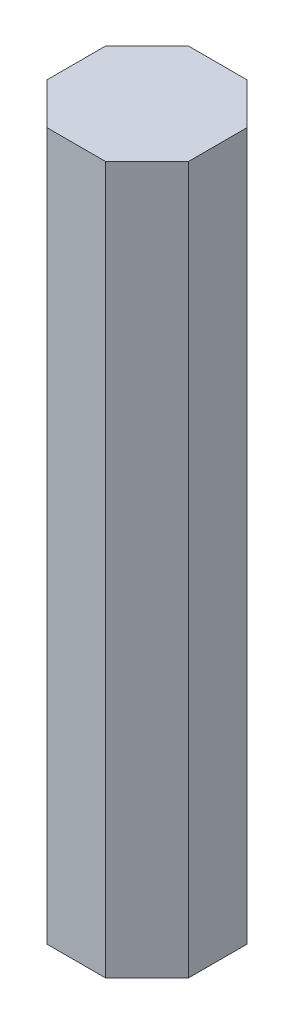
SolidWorks part; units mm, degrees
ref_plane "Plan de face" through (0, 0, 0) normal (0, 0, 1) x (1, 0, 0)
ref_plane "Plan de dessus" through (0, 0, 0) normal (0, 1, 0) x (1, 0, 0)
ref_plane "Plan de droite" through (0, 0, 0) normal (1, 0, 0) x (0, 0, -1)
sketch "Esquisse1" plane through (0, 0, 0) normal (0, 1, 0) x (1, 0, 0)
  line L1 (41.4214, -100) -> (100, -41.4214)
  line L2 (100, -41.4214) -> (100, 41.4214)
  line L3 (100, 41.4214) -> (41.4214, 100)
  line L4 (41.4214, 100) -> (-41.4214, 100)
  line L5 (-41.4214, 100) -> (-100, 41.4214)
  line L6 (-100, 41.4214) -> (-100, -41.4214)
  line L7 (-100, -41.4214) -> (-41.4214, -100)
  line L8 (-41.4214, -100) -> (41.4214, -100)
  circle A0 centre (0, 0) radius 100 construction
  dimension "D1" = 200
extrude "Forme extérieure" add sketch "Esquisse1" along normal blind 1000
